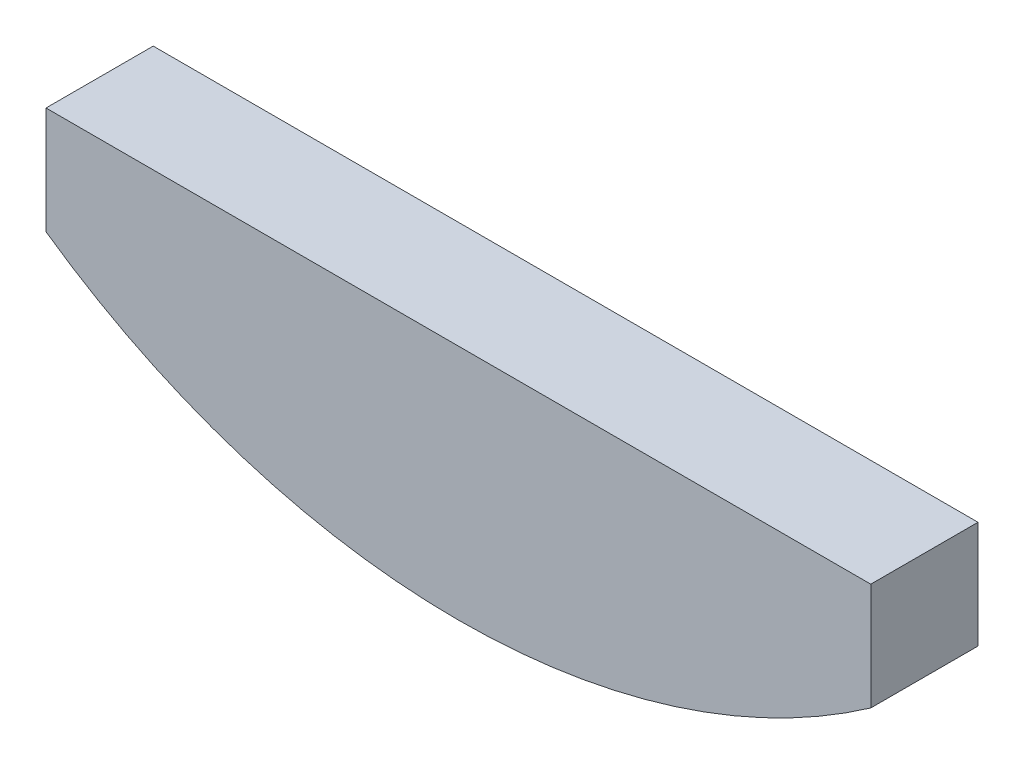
SolidWorks part; units mm, degrees
ref_plane "Alzado" through (0, 0, 0) normal (0, 0, 1) x (1, 0, 0)
ref_plane "Planta" through (0, 0, 0) normal (0, 1, 0) x (1, 0, 0)
ref_plane "Vista lateral" through (0, 0, 0) normal (1, 0, 0) x (0, 0, -1)
sketch "Croquis1" plane through (0, 0, 0) normal (0, 0, 1) x (1, 0, 0)
  line L0 (-3.0123, 25.4828) -> (-3.0123, 17.4828) construction
  line L1 (6.9877, 27.4828) -> (6.9877, 24.8828)
  line L2 (-13.0123, 27.4828) -> (-13.0123, 24.8828)
  line L6 (-13.0123, 27.4828) -> (6.9877, 27.4828)
  arc A9 (6.9877, 24.8828) -> (-13.0123, 24.8828) centre (-3.0123, 39.1555) cw
  point P2 (-2.3759, 11.2253)
  point P13 (21.9877, 24.8828)
  dimension "D5" = 8
  dimension "D1" = 10
  dimension "D2" = 2.6
  dimension "D6" = 10
  dimension "D8" = 15
  dimension "D9" = 10
extrude "Saliente-Extruir1" add sketch "Croquis1" along normal blind 2.6
